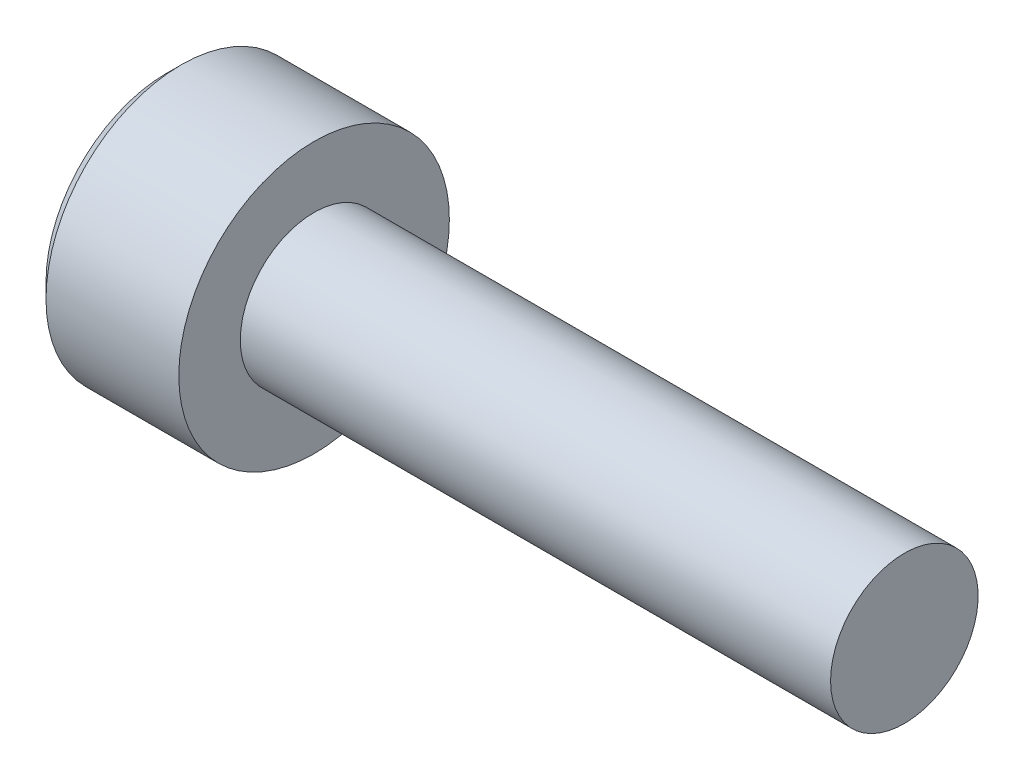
SolidWorks part; units mm, degrees
ref_plane "Front Plane" through (0, 0, 0) normal (0, 0, 1) x (1, 0, 0)
ref_plane "Top Plane" through (0, 0, 0) normal (0, 1, 0) x (1, 0, 0)
ref_plane "Right Plane" through (0, 0, 0) normal (1, 0, 0) x (0, 0, -1)
sketch "Sketch1" plane through (0, 0, 0) normal (0, 0, 1) x (1, 0, 0)
  line L2 (-3, 0) -> (12, 0)
  line L3 (12, 0) -> (12, 1.5)
  line L4 (12, 1.5) -> (0, 1.5)
  line L5 (0, 1.5) -> (0, 2.75)
  line L6 (0, 2.75) -> (-3, 2.75)
  line L7 (-3, 2.75) -> (-3, 0)
  line L8 (-3, 0) -> (12, 0) construction
  line L9 (0, 0) -> (0, 2.75) construction
  dimension "E" = 3
  dimension "L" = 12
  dimension "A" = 5.5
  dimension "M" = 3
revolve "Revolve1" add sketch "Sketch1" about L8
chamfer "Chamfer1" distance 0.3 1 edges at (-3, 0, 2.75)
sketch "Sketch2" plane through (0, 0, 0) normal (0, 0, 1) x (1, 0, 0)
  line L0 (-0.9489, 0) -> (-1.7, 1.25)
  line L1 (-3, 0) -> (12, 0) construction
  line L2 (-1.7, 1.25) -> (-3, 1.25)
  line L3 (-3, 2.75) -> (-3, 0) construction
  line L4 (-3, 1.25) -> (-3, 0)
  line L5 (-3, 0) -> (-0.9489, 0) construction
  line L6 (-0.9489, 0) -> (-3, 0)
  dimension "FIX_3" = 59
revolve "Cut-Revolve1" cut sketch "Sketch2" about L5
sketch "Sketch3" plane through (-3, 0, 0) normal (-1, 0, 0) x (0, 0, 1)
  line L0 (0, -1.4434) -> (0, 1.4434) construction
  line L1 (0, -1.4434) -> (1.25, -0.7217)
  line L2 (1.25, -0.7217) -> (1.25, 0.7217)
  line L3 (1.25, 0.7217) -> (0, 1.4434)
  line L4 (0, 1.4434) -> (-1.25, 0.7217)
  line L5 (-1.25, 0.7217) -> (-1.25, -0.7217)
  line L6 (-1.25, -0.7217) -> (0, -1.4434)
  line L7 (-1.25, 0) -> (1.25, 0) construction
  circle A0 centre (0, 0) radius 1.25 construction
extrude "Cut-Extrude1" cut sketch "Sketch3" against normal blind 1.3
